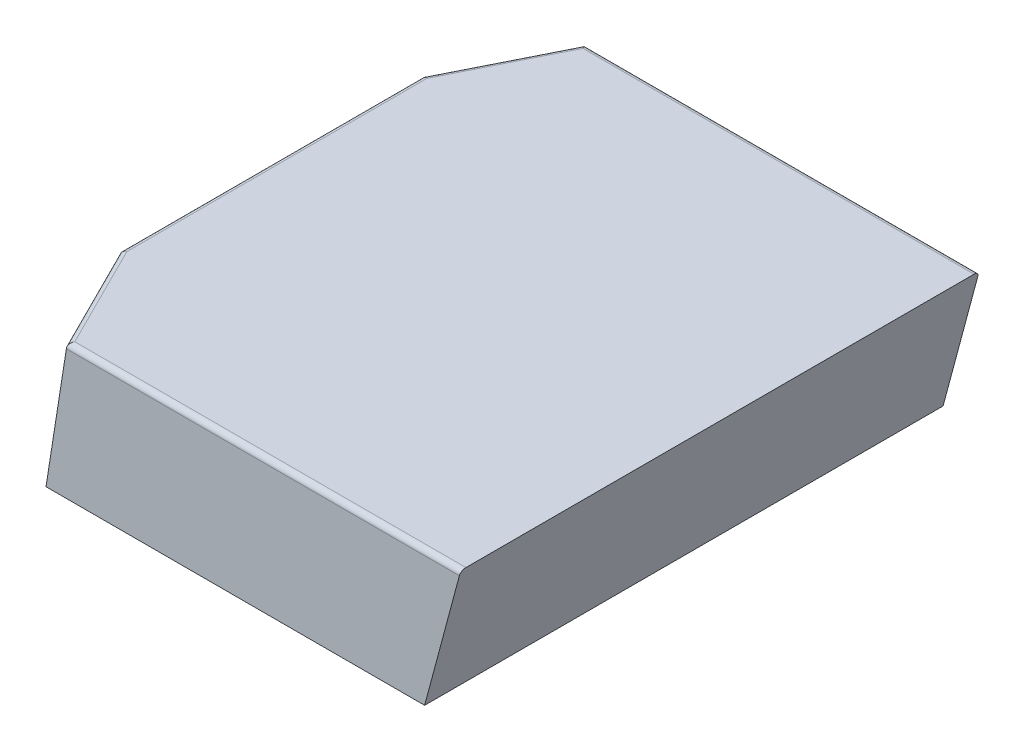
SolidWorks part; units mm, degrees
ref_plane "Front Plane" through (0, 0, 0) normal (0, 0, 1) x (1, 0, 0)
ref_plane "Top Plane" through (0, 0, 0) normal (0, 1, 0) x (1, 0, 0)
ref_plane "Right Plane" through (0, 0, 0) normal (1, 0, 0) x (0, 0, -1)
sketch "Sketch2" plane through (0, 0, 0) normal (0, 0, 1) x (1, 0, 0)
  line L0 (0, 0) -> (900, 0)
  line L1 (0, 0) -> (0, -260)
  line L2 (0, -260) -> (830.3332, -260)
  line L3 (830.3332, -260) -> (900, 0)
  dimension "D1" = 900
  dimension "D2" = 260
  dimension "D3" = 105
extrude "Boss-Extrude1" add sketch "Sketch2" along normal blind 1000
sketch "Sketch3" plane through (0, -260, 0) normal (0, -1, 0) x (1, 0, 0)
  line L0 (0, 1000) -> (100, 1000)
  line L1 (0, 1000) -> (830.3332, 1000) construction
  line L2 (100, 1000) -> (0, 800)
  line L3 (0, 1000) -> (0, 0) construction
  line L4 (0, 800) -> (0, 1000)
  line L5 (0, 500) -> (-141.8645, 500) construction
  line L6 (0, 200) -> (0, 0)
  line L7 (100, 0) -> (0, 200)
  line L8 (0, 0) -> (100, 0)
  dimension "D1" = 100
  dimension "D2" = 200
extrude "Cut-Extrude1" cut sketch "Sketch3" against normal through all draft 8
sketch "Sketch4" plane through (0, 0, 1000) normal (0, 0, 1) x (1, 0, 0)
  line L0 (0, 0) -> (0, -260)
  line L1 (0, -260) -> (36.5406, 0)
  line L2 (0, 0) -> (140.8537, 0) construction
  line L3 (36.5406, 0) -> (0, 0)
  dimension "D1" = 8
extrude "Cut-Extrude2" cut sketch "Sketch4" against normal blind 1000
fillet "Fillet1" radius 10 5 edges at (520.4268, 0, 0) (88.6971, 0, 104.313) (36.5406, 0, 500) (88.6971, 0, 895.687) (520.4268, 0, 1000)
